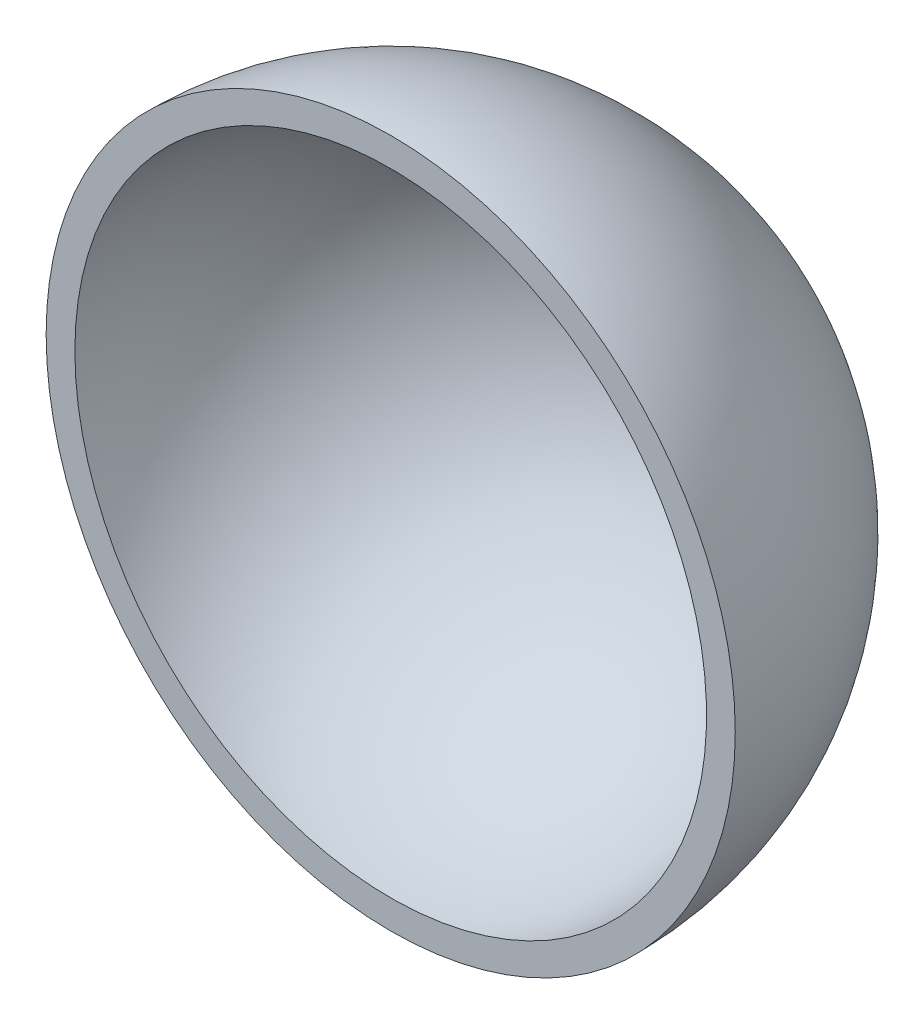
SolidWorks part; units mm, degrees
ref_plane "Plan de face" through (0, 0, 0) normal (0, 0, 1) x (1, 0, 0)
ref_plane "Plan de dessus" through (0, 0, 0) normal (0, 1, 0) x (1, 0, 0)
ref_plane "Plan de droite" through (0, 0, 0) normal (1, 0, 0) x (0, 0, -1)
sketch "Esquisse1" plane through (0, 0, 0) normal (0, 1, 0) x (1, 0, 0)
  line L0 (-24, 0) -> (-22, 0)
  line L2 (0, 24) -> (0, 22)
  arc A2 (-24, 0) -> (0, 24) centre (0, 0) cw
  arc A3 (-22, 0) -> (0, 22) centre (0, 0) cw
  dimension "D1" = 22
  dimension "D2" = 24
revolve "Révolution1" add sketch "Esquisse1" angle 360 about L2
